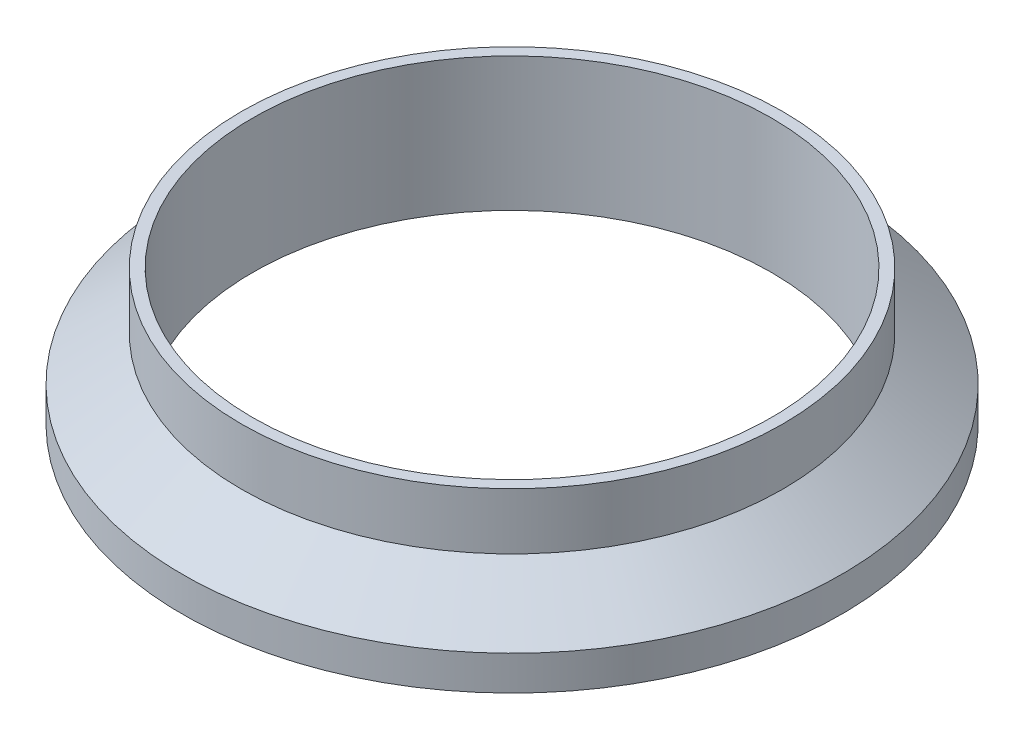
SolidWorks part; units mm, degrees
ref_plane "Front Plane" through (0, 0, 0) normal (0, 0, 1) x (1, 0, 0)
ref_plane "Top Plane" through (0, 0, 0) normal (0, 1, 0) x (1, 0, 0)
ref_plane "Right Plane" through (0, 0, 0) normal (1, 0, 0) x (0, 0, -1)
sketch "Sketch1" plane through (0, 0, 0) normal (0, 0, 1) x (1, 0, 0)
  line L0 (-48.6918, 0.2888) -> (-48.6918, 25.4)
  line L1 (-48.6918, 25.4) -> (-50.8, 25.4)
  line L2 (-50.8, 25.4) -> (-50.8, 14.803)
  line L3 (-50.8, 14.803) -> (-61.849, 6.477)
  line L4 (-61.849, 6.477) -> (-61.849, 0)
  line L5 (-61.849, 0) -> (-58.2413, 0)
  line L6 (-48.6918, 0.2888) -> (-52.8126, 0.2888)
  line L7 (0, 0) -> (0, 37.9334) construction
  arc A0 (-52.8126, 0.2888) -> (-58.2413, 0) centre (-55.499, -0.381) ccw
  dimension "D1" = 5.5372
  dimension "D2" = 48.6918
  dimension "D3" = 50.8
  dimension "D4" = 55.499
  dimension "D5" = 61.849
  dimension "D6" = 6.477
  dimension "D7" = 25.4
  dimension "D8" = 127
  dimension "D9" = 0.381
revolve "Revolve1" add sketch "Sketch1" angle 360 about L7
